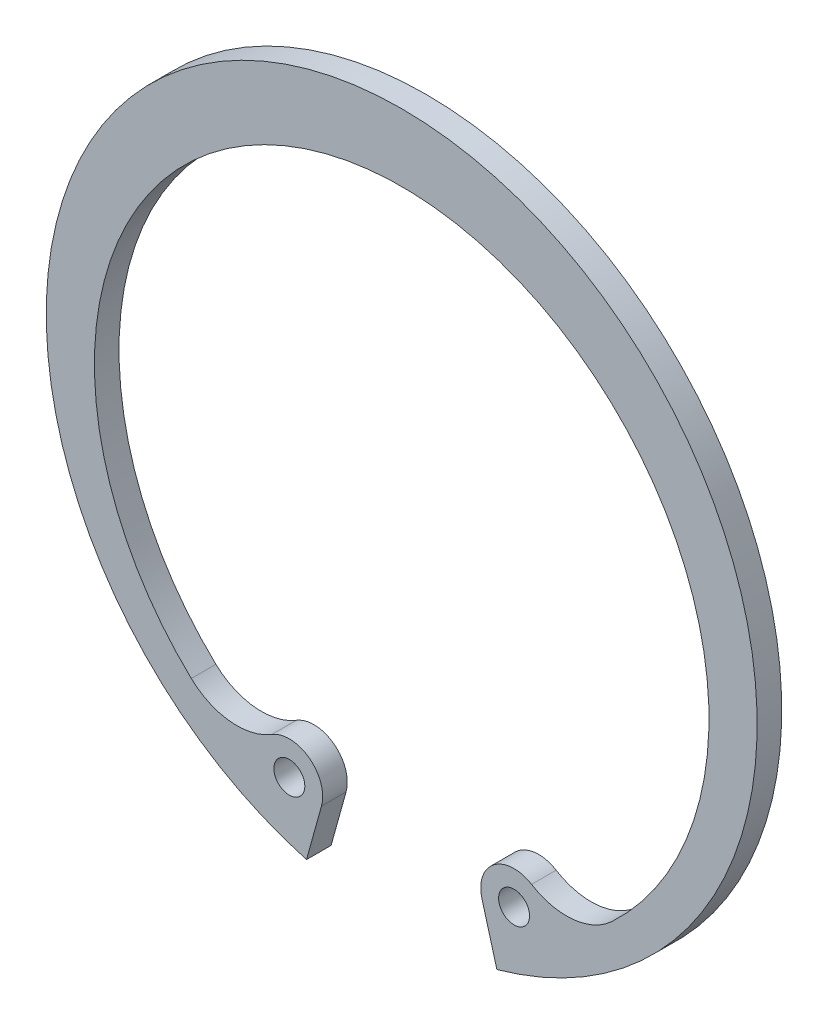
SolidWorks part; units mm, degrees
ref_plane "Plane1" through (0, 0, 0) normal (0, 0, 1) x (1, 0, 0)
ref_plane "Plane2" through (0, 0, 0) normal (0, 1, 0) x (1, 0, 0)
ref_plane "Plane3" through (0, 0, 0) normal (1, 0, 0) x (0, 0, -1)
sketch "Clipboard" plane through (0, 0, 0) normal (0, 0, 1) x (1, 0, 0)
  line L0 (0, 0) -> (4.318, 0)
  line L1 (0, 0) -> (0, 2.159)
  line L2 (0, 0) -> (0, -5.588)
  circle A0 centre (0, 0) radius 0.9906
  circle A1 centre (0, 0) radius 21.4376
  dimension "HoleDia" = 1.9812
  dimension "BoreDia" = 42.8752
  dimension "LargeSection" = 4.318
  dimension "SmallSection" = 2.159
  dimension "LugSection" = 5.588
sketch "BodySke" plane through (0, 0, 0) normal (0, 0, 1) x (1, 0, 0)
  line L0 (-1.5431, 0) -> (1.5431, 0) construction
  line L1 (0, 0) -> (0, 18.4404) construction
  line L2 (6.0946, -21.9272) -> (5.1378, -18.485)
  line L3 (-6.0946, -21.9272) -> (-5.1378, -18.485)
  line L4 (0, 0) -> (14.7033, -17.3711) construction
  line L5 (0, 0) -> (-14.7033, -17.3711) construction
  line L6 (-6.9282, -16.9592) -> (-7.4588, -18.868) construction
  line L7 (6.9925, -17.1905) -> (7.3945, -18.6368) construction
  arc A0 (-5.1378, -18.485) -> (-8.3119, -16.0967) centre (-7.1935, -17.9136) ccw
  arc A1 (8.3119, -16.0967) -> (5.1378, -18.485) centre (7.1935, -17.9136) ccw
  arc A2 (13.3085, -15.7232) -> (-13.3085, -15.7232) centre (0, -1.2336) ccw construction
  arc A3 (6.0946, -21.9272) -> (-6.0946, -21.9272) centre (0, 0) ccw
  circle A4 centre (7.1935, -17.9136) radius 0.9906
  circle A5 centre (-7.1935, -17.9136) radius 0.9906
  arc A7 (13.4704, -15.5728) -> (-13.4704, -15.5728) centre (0, -1.2336) ccw
  arc A8 (-7.1935, -17.9136) -> (7.1935, -17.9136) centre (0, 0) ccw construction
  arc A9 (-13.4704, -15.5728) -> (-8.3119, -16.0967) centre (-10.5487, -12.4627) ccw
  arc A10 (8.3119, -16.0967) -> (13.4704, -15.5728) centre (10.5487, -12.4627) ccw
  dimension "GrooveDia" = 45.5168
  dimension "TipRad" = 2.1336
  dimension "HoleOffsetRad" = 19.304
  dimension "HoleDia" = 1.9812
  dimension "FilletRad" = 4.2672
  dimension "LargeRad" = 18.4404
  dimension "SmallRad" = 20.5994
  dimension "SmallAngle" = 80.491
  dimension "GapAngle" = 31.066
extrude "Body" add sketch "BodySke" against normal blind 1.5748
sketch "ModLugSke" plane through (0, 0, 0) normal (0, 0, 1) x (1, 0, 0)
  line L0 (6.0946, -21.9272) -> (4.8562, -17.4716)
  line L1 (-6.0946, -21.9272) -> (-4.8562, -17.4716)
  line L2 (12.7201, -11.5335) -> (16.8598, -15.287) construction
  line L3 (-12.7201, -11.5335) -> (-16.8598, -15.287) construction
  line L4 (-6.0946, -21.9272) -> (-5.1378, -18.485) construction
  line L5 (5.1378, -18.485) -> (6.0946, -21.9272) construction
  line L6 (0, 0) -> (0, -12.7358) construction
  line L7 (15.1697, -13.7546) -> (16.8598, -15.287)
  line L8 (-16.8598, -15.287) -> (-15.1697, -13.7546)
  arc A0 (6.0946, -21.9272) -> (16.8598, -15.287) centre (0, 0) ccw
  arc A1 (-9.6516, -14.201) -> (-5.4936, -16.2678) centre (0, 0) ccw
  arc A2 (6.0946, -21.9272) -> (-6.0946, -21.9272) centre (0, 0) ccw construction
  arc A3 (8.3119, -16.0967) -> (5.1378, -18.485) centre (7.1935, -17.9136) ccw construction
  arc A4 (-9.6516, -14.201) -> (-10.7874, -14.2165) centre (-10.2084, -15.0203) ccw
  arc A5 (-15.1697, -13.7546) -> (-10.7874, -14.2165) centre (-12.7201, -11.5335) ccw
  arc A6 (13.4704, -15.5728) -> (-13.4704, -15.5728) centre (0, -1.2336) ccw construction
  arc A7 (10.7874, -14.2165) -> (15.1697, -13.7546) centre (12.7201, -11.5335) ccw
  arc A8 (5.4936, -16.2678) -> (9.6516, -14.201) centre (0, 0) ccw
  arc A9 (-16.8598, -15.287) -> (-6.0946, -21.9272) centre (0, 0) ccw
  circle A10 centre (-7.1935, -17.9136) radius 0.9906
  circle A11 centre (-7.1935, -17.9136) radius 0.9906 construction
  circle A12 centre (7.1935, -17.9136) radius 0.9906
  circle A13 centre (7.1935, -17.9136) radius 0.9906 construction
  arc A14 (-5.4936, -16.2678) -> (-4.8562, -17.4716) centre (-5.8106, -17.2064) cw
  arc A15 (5.4936, -16.2678) -> (4.8562, -17.4716) centre (5.8106, -17.2064) ccw
  arc A16 (9.6516, -14.201) -> (10.7874, -14.2165) centre (10.2084, -15.0203) cw
  point P43 (4.5981, -16.5433)
  dimension "LugAng" = 68.403
extrude "ModLug" [suppressed] add sketch "ModLugSke" against normal through all
equation "' \"BoreDia@Clipboard\" = 0.25"
equation "' \"Thickness@Body\" = 0.015"
equation "' \"GrooveDia@BodySke\" = 0.268"
equation "' \"LugSection@Clipboard\" = 0.065"
equation "' \"LargeSection@Clipboard\" = 0.025"
equation "' \"SmallSection@Clipboard\" = 0.015"
equation "' \"HoleDia@Clipboard\" = 0.031"
equation "' \"BoreDia@Clipboard\" = 1.0"
equation "' \"Thickness@Body\" = 0.042"
equation "' \"GrooveDia@BodySke\" = 1.066"
equation "' \"LugSection@Clipboard\" = 0.155"
equation "' \"LargeSection@Clipboard\" = 0.104"
equation "' \"SmallSection@Clipboard\" = 0.052"
equation "' \"HoleDia@Clipboard\" = 0.062"
equation "\"TipRad@BodySke\" = (\"LugSection@Clipboard\" - (\"GrooveDia@BodySke\" / 2  -  \"BoreDia@Clipboard\" / 2 ) ) / 2"
equation "\"HoleOffsetRad@BodySke\" = (\"GrooveDia@BodySke\" / 2) - \"LugSection@Clipboard\"  + \"TipRad@BodySke\""
equation "\"LargeRad@BodySke\" =  \"GrooveDia@BodySke\" / 2 -  \"LargeSection@Clipboard\""
equation "\"SmallRad@BodySke\" =  \"GrooveDia@BodySke\" / 2 -  \"SmallSection@Clipboard\""
equation "\"HoleDia@BodySke\" =  \"HoleDia@Clipboard\""
equation "\"FilletRad@BodySke\" = \"TipRad@BodySke\" * 2"
equation "\"GapAngle@BodySke\" = 360 - 0.97 * 360 * ( \"BoreDia@Clipboard\" /  \"GrooveDia@BodySke\")"
equation "\"LugAng@ModLugSke\" = \"GapAngle@BodySke\"  + 2.5 * 360 * (\"LugSection@Clipboard\" / (\"BoreDia@Clipboard\" * 3.1416))"
